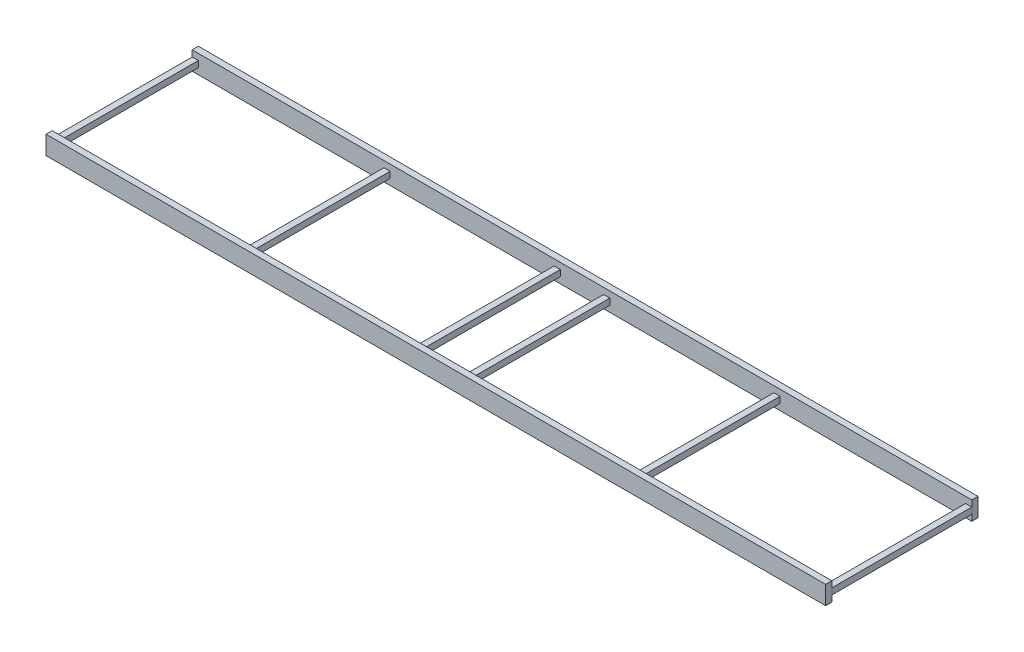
SolidWorks part; units mm, degrees
ref_plane "Front Plane" through (0, 0, 0) normal (0, 0, 1) x (1, 0, 0)
ref_plane "Top Plane" through (0, 0, 0) normal (0, 1, 0) x (1, 0, 0)
ref_plane "Right Plane" through (0, 0, 0) normal (1, 0, 0) x (0, 0, -1)
sketch "Sketch1" plane through (0, 0, 0) normal (0, 1, 0) x (1, 0, 0)
  line L0 (0, 37.5) -> (0, -37.5) construction
  line L1 (-200, -37.5) -> (200, -37.5)
  line L2 (-200, -37.5) -> (-200, 37.5)
  line L3 (-200, 37.5) -> (200, 37.5)
  line L4 (200, -37.5) -> (200, 37.5)
  line L5 (-200, -37.5) -> (200, 37.5) construction
  line L6 (-200, 37.5) -> (200, -37.5) construction
  line L7 (-100, 37.5) -> (-100, -37.5)
  line L8 (-12.7, -37.5) -> (-12.7, 37.5)
  line L9 (12.7, 37.5) -> (12.7, -37.5)
  line L10 (100, 37.5) -> (100, -37.5)
  point P0 (0, 0)
  dimension "D1" = 400
  dimension "D2" = 75
  dimension "D3" = 25.4
  dimension "D4" = 100
  dimension "D5" = 100
other "Structural Member1"
ref_plane "Plane1" through (-200, 0, 37.5) normal (1, 0, 0) x (0, 0, -1)
sketch "Sketch12" plane through (-200, 0, 37.5) normal (1, 0, 0) x (0, 0, -1)
  line L1 (-1.5875, -4.7625) -> (1.5875, -4.7625)
  line L2 (-1.5875, -4.7625) -> (-1.5875, 4.7625)
  line L3 (-1.5875, 4.7625) -> (1.5875, 4.7625)
  line L4 (1.5875, -4.7625) -> (1.5875, 4.7625)
  line L5 (-1.5875, -4.7625) -> (1.5875, 4.7625) construction
  line L6 (-1.5875, 4.7625) -> (1.5875, -4.7625) construction
  point P0 (0, 0)
  point P5 (0, 4.7625)
  point P6 (1.5875, 0)
  point P7 (0, -4.7625)
  point P8 (-1.5875, 0)
  point P9 (0, 0)
  dimension "D1" = 3.175
  dimension "D2" = 9.525
other "Structural Member2"
ref_plane "Plane2" through (200, 0, 37.5) normal (0, 0, -1) x (-1, 0, 0)
sketch "Sketch14" plane through (198.4125, 0, 37.5) normal (0, 0, -1) x (-1, 0, 0)
  line L1 (-1.5875, -1.5875) -> (1.5875, -1.5875)
  line L2 (-1.5875, -1.5875) -> (-1.5875, 1.5875)
  line L3 (-1.5875, 1.5875) -> (1.5875, 1.5875)
  line L4 (1.5875, -1.5875) -> (1.5875, 1.5875)
  line L5 (-1.5875, -1.5875) -> (1.5875, 1.5875) construction
  line L6 (-1.5875, 1.5875) -> (1.5875, -1.5875) construction
  point P0 (0, 0)
  point P5 (-1.5875, 0)
  point P6 (0, 1.5875)
  point P7 (1.5875, 0)
  point P8 (0, -1.5875)
  point P9 (0, 0)
  dimension "D1" = 3.175
other "Structural Member3"
ref_plane "Plane3" through (-200, 0, 37.5) normal (0, 0, -1) x (-1, 0, 0)
sketch "Sketch15" plane through (-198.4125, 0, 37.5) normal (0, 0, -1) x (-1, 0, 0)
  line L1 (-1.5875, -1.5875) -> (1.5875, -1.5875)
  line L2 (-1.5875, -1.5875) -> (-1.5875, 1.5875)
  line L3 (-1.5875, 1.5875) -> (1.5875, 1.5875)
  line L4 (1.5875, -1.5875) -> (1.5875, 1.5875)
  line L5 (-1.5875, -1.5875) -> (1.5875, 1.5875) construction
  line L6 (-1.5875, 1.5875) -> (1.5875, -1.5875) construction
  point P0 (0, 0)
  point P5 (-1.5875, 0)
  point P6 (0, 1.5875)
  point P7 (1.5875, 0)
  point P8 (0, -1.5875)
  point P9 (0, 0)
  dimension "D1" = 3.175
other "Structural Member4"
ref_plane "Plane4" through (-100, 0, -37.5) normal (0, 0, 1) x (1, 0, 0)
sketch "Sketch16" plane through (-100, 0, -37.5) normal (0, 0, 1) x (1, 0, 0)
  line L1 (-1.5875, -1.5875) -> (1.5875, -1.5875)
  line L2 (-1.5875, -1.5875) -> (-1.5875, 1.5875)
  line L3 (-1.5875, 1.5875) -> (1.5875, 1.5875)
  line L4 (1.5875, -1.5875) -> (1.5875, 1.5875)
  line L5 (-1.5875, -1.5875) -> (1.5875, 1.5875) construction
  line L6 (-1.5875, 1.5875) -> (1.5875, -1.5875) construction
  point P0 (0, 0)
  point P5 (-1.5875, 0)
  point P6 (0, 1.5875)
  point P7 (1.5875, 0)
  point P8 (0, -1.5875)
  point P9 (0, 0)
  dimension "D1" = 3.175
other "Trim/Extend1"
equation "\"D2@Sketch12\" = \"D1@Sketch12\" * 3"
